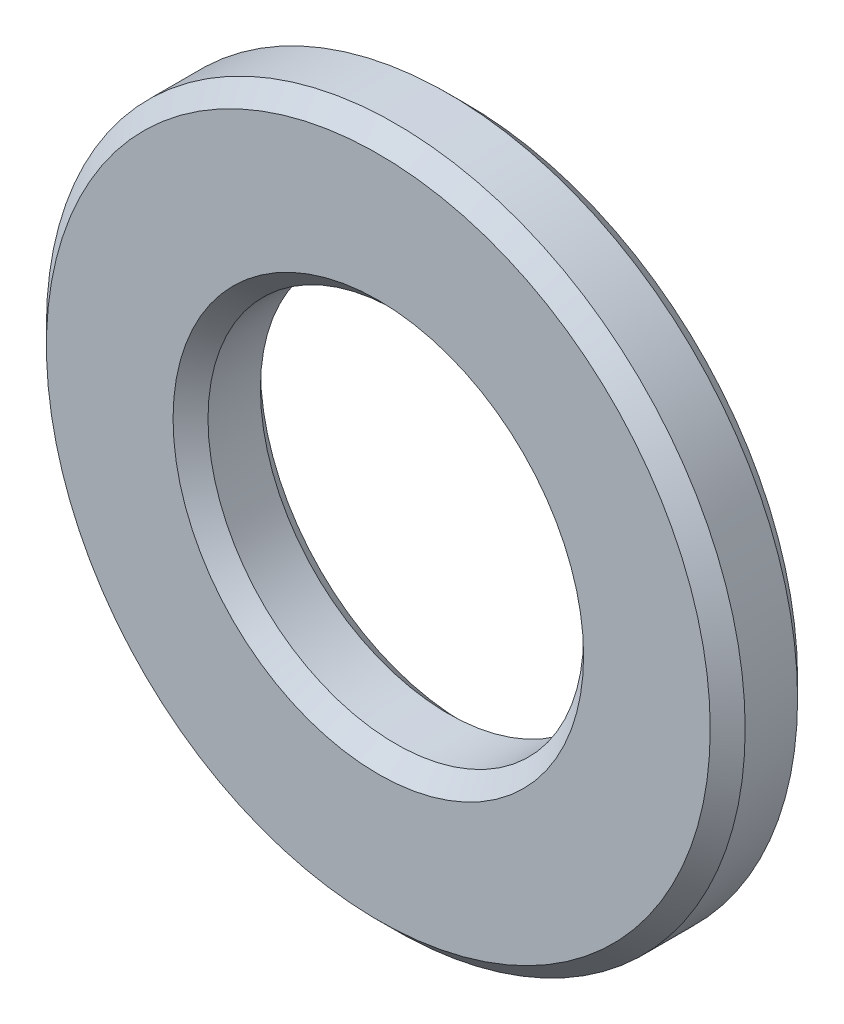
SolidWorks part; units mm, degrees
ref_plane "Front Plane" through (0, 0, 0) normal (0, 0, 1) x (1, 0, 0)
ref_plane "Top Plane" through (0, 0, 0) normal (0, 1, 0) x (1, 0, 0)
ref_plane "Right Plane" through (0, 0, 0) normal (1, 0, 0) x (0, 0, -1)
sketch "Sketch1" plane through (0, 0, 0) normal (0, 0, 1) x (1, 0, 0)
  circle A0 centre (0, 0) radius 4
  circle A1 centre (0, 0) radius 2.15
  dimension "D1" = 8
  dimension "D2" = 4.3
extrude "Boss-Extrude2" add sketch "Sketch1" along normal mid plane 1
chamfer "Chamfer3" distance 0.2 angle 45 4 edges at (4, 0, 0.5) (4, 0, -0.5) (2.15, 0, -0.5) (2.15, 0, 0.5)
